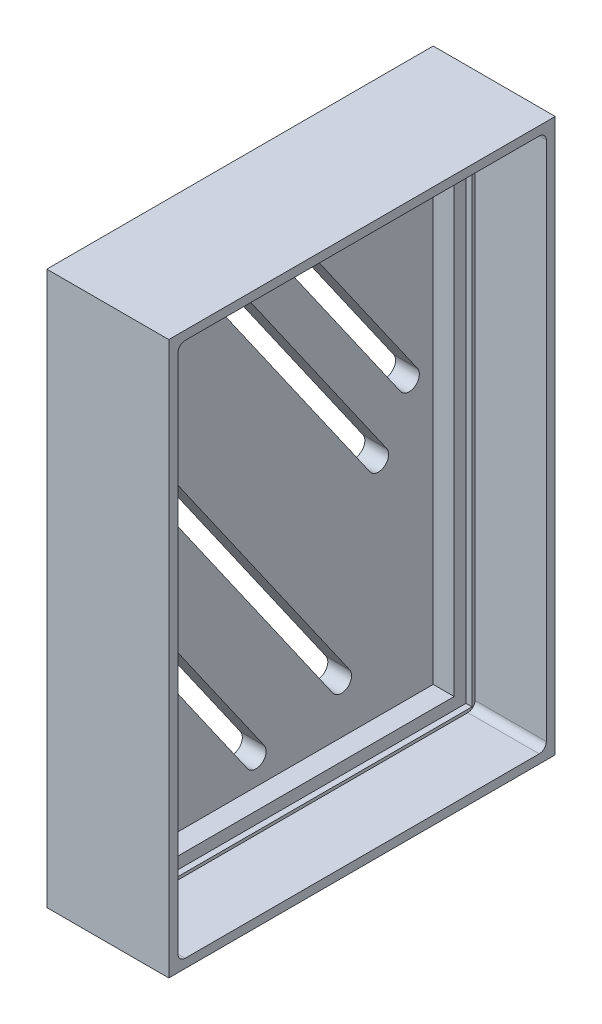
SolidWorks part; units mm, degrees
ref_plane "Front Plane" through (0, 0, 0) normal (0, 0, 1) x (1, 0, 0)
ref_plane "Top Plane" through (0, 0, 0) normal (0, 1, 0) x (1, 0, 0)
ref_plane "Right Plane" through (0, 0, 0) normal (1, 0, 0) x (0, 0, -1)
sketch "Sketch1" plane through (0, 0, 0) normal (1, 0, 0) x (0, 0, -1)
  line L1 (-14.5968, 25.3477) -> (17.9032, 25.3477)
  line L2 (-14.5968, 25.3477) -> (-14.5968, -21.1523)
  line L3 (-14.5968, -21.1523) -> (17.9032, -21.1523)
  line L4 (17.9032, 25.3477) -> (17.9032, -21.1523)
  dimension "D1" = 46.5
  dimension "D2" = 32.5
extrude "Boss-Extrude2" add sketch "Sketch1" along normal blind 10.2612
shell "Shell1" thickness 2
sketch "Sketch2" plane through (0, 0, 0) normal (-1, 0, 0) x (0, 0, 1)
  line L1 (5.4387, 5.9102) -> (-8.8831, -14.5809)
  line L2 (9.7623, -0.099) -> (-1.6951, -16.4919)
  line L3 (6.8525, 4.9221) -> (-7.4693, -15.5691)
  line L4 (2.3234, 20.4718) -> (-11.9984, -0.0194)
  line L5 (3.7372, 19.4836) -> (-10.5846, -1.0076)
  line L6 (-3.1253, 20.9174) -> (-14.5815, 4.5264)
  line L7 (11.1721, -1.0843) -> (-0.285, -17.4768)
  line L8 (-1.7156, 19.9321) -> (-13.1711, 3.5419)
  arc A0 (5.4387, 5.9102) -> (6.8525, 4.9221) centre (6.1456, 5.4161) cw
  arc A1 (-8.8831, -14.5809) -> (-7.4693, -15.5691) centre (-8.1762, -15.075) ccw
  arc A2 (9.7623, -0.099) -> (11.1721, -1.0843) centre (10.4672, -0.5917) cw
  arc A3 (-1.6951, -16.4919) -> (-0.285, -17.4768) centre (-0.9901, -16.9843) ccw
  arc A4 (2.3234, 20.4718) -> (3.7372, 19.4836) centre (3.0303, 19.9777) cw
  arc A5 (-11.9984, -0.0194) -> (-10.5846, -1.0076) centre (-11.2915, -0.5135) ccw
  arc A6 (-3.1253, 20.9174) -> (-1.7156, 19.9321) centre (-2.4205, 20.4248) cw
  arc A7 (-14.5815, 4.5264) -> (-13.1711, 3.5419) centre (-13.8763, 4.0341) ccw
  dimension "D4" = 0.86
  dimension "D1" = 25
  dimension "D2" = 20
extrude "Cut-Extrude1" cut sketch "Sketch2" against normal blind 6
sketch "Sketch3" plane through (10.2612, 0, 0) normal (1, 0, 0) x (0, 0, -1)
  circle A0 centre (15.9032, 23.3477) radius 1.5
  circle A1 centre (-12.5968, -19.1523) radius 1.5
  dimension "D1" = 3
  dimension "D2" = 3
extrude "Boss-Extrude3" add sketch "Sketch3" against normal up to vertex (10.2612 mm away)
sketch "Sketch4" plane through (10.2612, 0, 0) normal (1, 0, 0) x (0, 0, -1)
  line L0 (-13.5726, 24.3477) -> (-13.5726, -20.1523)
  line L1 (-14.5968, -21.1523) -> (17.9032, -21.1523) construction
  line L2 (17.9032, 25.3477) -> (-14.5968, 25.3477) construction
  line L3 (-13.5726, 24.3477) -> (16.9032, 24.3477)
  line L4 (17.9032, -21.1523) -> (17.9032, 25.3477) construction
  line L5 (16.9032, 24.3477) -> (16.9032, -20.1523)
  line L7 (-13.5726, -20.1523) -> (-12.5968, -20.1523)
  line L8 (-12.5968, -20.1523) -> (-12.5968, 23.3477)
  line L9 (-12.5968, 23.3477) -> (15.9032, 23.3477)
  line L10 (15.9032, 23.3477) -> (15.9032, -20.1523)
  line L11 (15.9032, -20.1523) -> (16.9032, -20.1523)
  dimension "D1" = 1
  dimension "D2" = 1
  dimension "D3" = 1
  dimension "D4" = 1
extrude "Cut-Extrude2" cut sketch "Sketch4" against normal blind 6.5
sketch "Sketch5" plane through (10.2612, 0, 0) normal (1, 0, 0) x (0, 0, -1)
  line L0 (-12.5968, -20.1523) -> (15.9032, -20.1523)
  line L1 (15.9032, -20.1523) -> (15.9032, -19.1523)
  line L2 (15.9032, -19.1523) -> (-12.5968, -19.1523)
  line L3 (-12.5968, -19.1523) -> (-12.5968, -20.1523)
extrude "Cut-Extrude3" cut sketch "Sketch5" against normal blind 6.5
sketch "Sketch6" plane through (10.2612, 0, 0) normal (1, 0, 0) x (0, 0, -1)
  line L0 (-12.5968, -17.6523) -> (-12.5968, -19.1523)
  line L1 (-12.5968, -19.1523) -> (-11.0968, -19.1523)
  line L2 (15.9032, 23.3477) -> (15.9032, 21.8477)
  line L3 (14.4032, 23.3477) -> (15.9032, 23.3477)
  arc A0 (-11.0968, -19.1523) -> (-12.5968, -17.6523) centre (-12.5968, -19.1523) ccw
  arc A1 (15.9032, 21.8477) -> (14.4032, 23.3477) centre (15.9032, 23.3477) cw
extrude "Cut-Extrude4" cut sketch "Sketch6" against normal blind 6.5
sketch "Sketch8" plane through (10.2612, 0, 0) normal (1, 0, 0) x (0, 0, -1)
  line L0 (17.1532, 24.3047) -> (17.1532, -20.4023)
  line L1 (17.1532, -20.4023) -> (7.3643, -20.4023)
  line L2 (-13.5726, -20.1523) -> (16.9032, -20.1523) construction
  line L3 (16.9032, -20.1523) -> (16.9032, 24.3477) construction
  line L4 (17.1532, 24.3047) -> (17.1532, 24.5977)
  line L5 (17.1532, 24.5977) -> (15.4267, 24.5977)
  line L6 (16.9032, 24.3477) -> (-13.5726, 24.3477) construction
  line L7 (15.4267, 24.5977) -> (-13.8226, 24.5977)
  line L8 (-13.8226, 24.5977) -> (-13.8226, 19.2308)
  line L9 (-13.5726, 24.3477) -> (-13.5726, -20.1523) construction
  line L10 (-13.8226, 19.2308) -> (-13.8226, -20.4023)
  line L11 (-13.8226, -20.4023) -> (-13.5726, -20.4023)
  line L12 (-13.5726, -20.4023) -> (-13.5726, 24.3477)
  line L13 (-13.5726, 24.3477) -> (16.9032, 24.3477)
  line L14 (16.9032, 24.3477) -> (16.9032, -20.1523)
  line L15 (16.9032, -20.1523) -> (7.3643, -20.1523)
  line L16 (7.3643, -20.1523) -> (7.3643, -20.4023)
  dimension "D1" = 0.25
  dimension "D2" = 0.25
  dimension "D3" = 0.25
  dimension "D4" = 0.25
extrude "Cut-Extrude5" cut sketch "Sketch8" against normal blind 6
sketch "Sketch9" plane through (10.2612, 0, 0) normal (1, 0, 0) x (0, 0, -1)
  line L0 (-13.5726, -20.4023) -> (7.3643, -20.4023)
  line L1 (7.3643, -20.4023) -> (7.3643, -20.1523)
  line L2 (7.3643, -20.1523) -> (-13.5726, -20.1523)
  line L3 (-13.5726, -20.1523) -> (-13.5726, -20.4023)
extrude "Cut-Extrude6" cut sketch "Sketch9" against normal blind 6
fillet "Fillet1" radius 0.6 4 edges at (7.2612, 24.5977, 13.8226) (7.2612, 24.5977, -17.1532) (7.2612, -20.4023, -17.1532) (7.2612, -20.4023, 13.8226)
